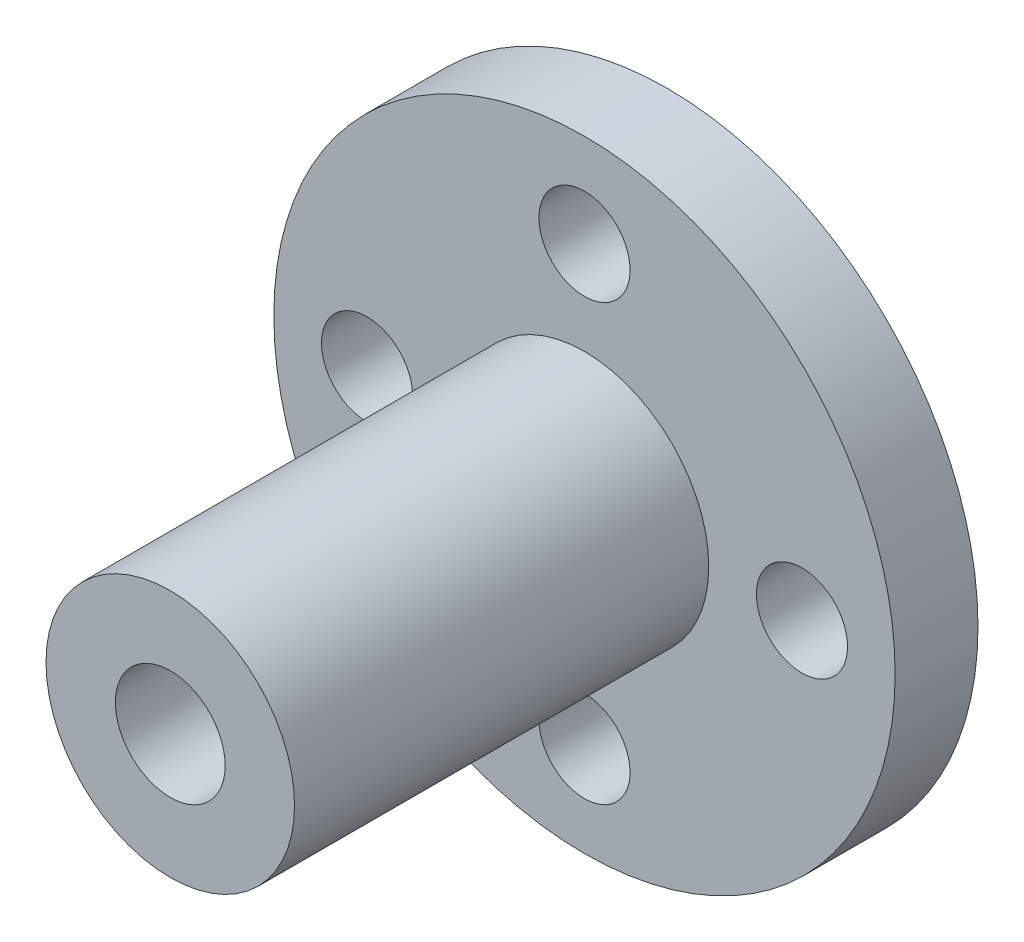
SolidWorks part; units mm, degrees
ref_plane "Front Plane" through (0, 0, 0) normal (0, 0, 1) x (1, 0, 0)
ref_plane "Top Plane" through (0, 0, 0) normal (0, 1, 0) x (1, 0, 0)
ref_plane "Right Plane" through (0, 0, 0) normal (1, 0, 0) x (0, 0, -1)
sketch "Sketch1" plane through (0, 0, 0) normal (0, 0, 1) x (1, 0, 0)
  circle A0 centre (0, 0) radius 75
  dimension "D1" = 150
extrude "Extrude1" add sketch "Sketch1" along normal blind 20
sketch "Sketch2" plane through (0, 0, 20) normal (0, 0, 1) x (1, 0, 0)
  line L0 (0, 0) -> (52.5, 0) construction
  circle A0 centre (52.5, 0) radius 11
  circle A1 centre (0, 0) radius 52.5 construction
  dimension "D1" = 105
  dimension "D2" = 22
extrude "Extrude2" cut sketch "Sketch2" against normal through all
pattern_circular "CirPattern1" count 4 over 360 about axis through (0, 0, 0) along (0, 0, 1) of "Extrude2"
sketch "Sketch4" plane through (0, 0, 20) normal (0, 0, -1) x (-1, 0, 0)
  circle A0 centre (0, 0) radius 30
  dimension "D1" = 60
extrude "Extrude4" add sketch "Sketch4" against normal blind 100
sketch "Sketch3" plane through (0, 0, 0) normal (0, 0, 1) x (1, 0, 0)
  circle A0 centre (0, 0) radius 13.25
  dimension "D1" = 26.5
extrude "Extrude3" cut sketch "Sketch3" along normal through all
